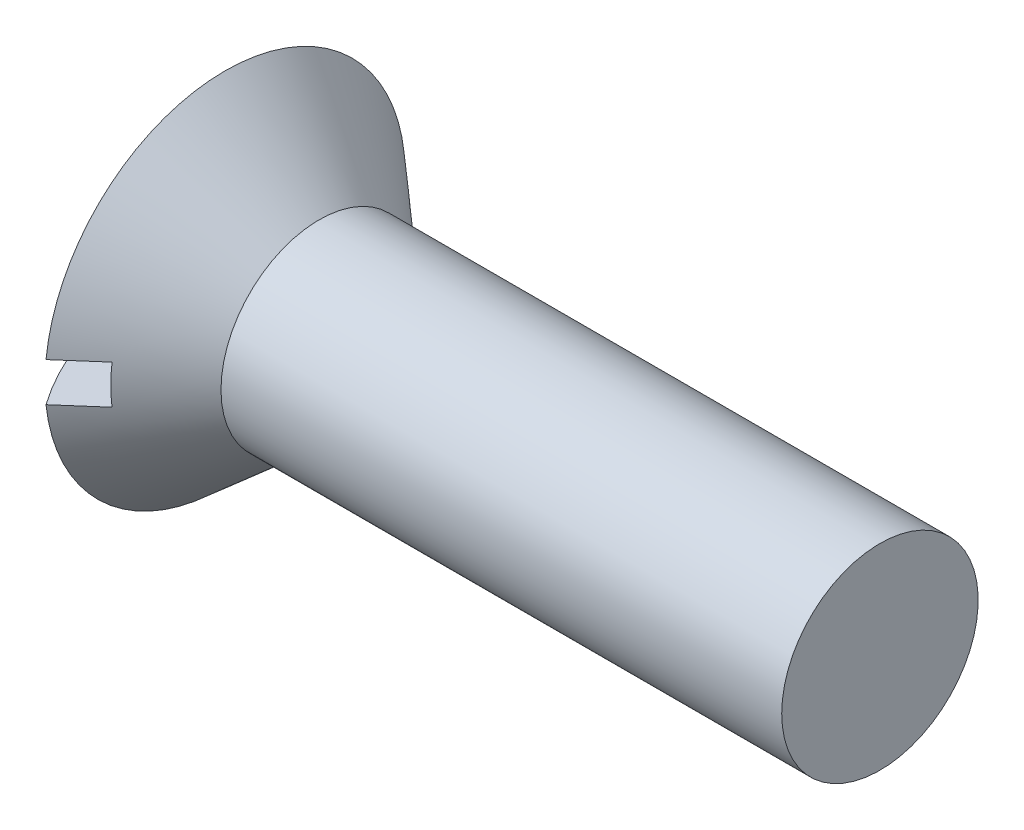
SolidWorks part; units mm, degrees
revolve "Base-Revolve" add sketch "BodySke" angle 360 about L4
sketch "BodySke" plane through (0, 0, 0) normal (0, 0, 1) x (1, 0, 0)
  line L0 (0, 0) -> (69.0502, 0)
  line L1 (69.0502, 0) -> (69.0502, 9.525)
  line L2 (69.0502, 9.525) -> (14.6812, 9.525)
  line L3 (5.5502, -17.4625) -> (14.6812, -9.525) construction
  line L4 (-15.875, 0) -> (82.55, 0) construction
  line L5 (5.5502, 17.4625) -> (14.6812, 9.525)
  line L6 (15.4749, 12.7) -> (15.475, -3.175) construction
  line L7 (37.3002, 12.7) -> (37.3002, -3.175) construction
  arc A0 (0, 0) -> (5.5502, 17.4625) centre (30.2463, 0) cw
extrude "Slot" cut sketch "Sketch2" along normal blind 8.9662
sketch "Sketch2" plane through (0, 0, 0) normal (1, 0, 0) x (0, 0, -1)
  line L0 (17.4625, -1.8923) -> (-17.4625, -1.8923)
  line L1 (17.4625, -1.8923) -> (17.4625, 1.8923)
  line L2 (-17.4625, 1.8923) -> (17.4625, 1.8923)
  line L3 (-17.4625, 1.8923) -> (-17.4625, -1.8923)
ref_plane "Plane1" through (0, 0, 0) normal (0, 0, 1) x (1, 0, 0)
ref_plane "Plane2" through (0, 0, 0) normal (0, 1, 0) x (1, 0, 0)
ref_plane "Plane3" through (0, 0, 0) normal (1, 0, 0) x (0, 0, -1)
other "Configuration Table"
sketch "Sketch3" plane through (0, 0, 0) normal (1, 0, 0) x (0, 0, -1)
  line L0 (1.3208, -8.3312) -> (-1.3208, -8.3312)
  line L1 (1.3208, -8.3312) -> (1.3208, 8.3312)
  line L2 (-1.3208, 8.3312) -> (1.3208, 8.3312)
  line L3 (-1.3208, 8.3312) -> (-1.3208, -8.3312)
ref_plane "Plane4" through (10.16, 0, 0) normal (1, 0, 0) x (0, 0, -1)
sketch "Sketch4" plane through (10.16, 0, 0) normal (1, 0, 0) x (0, 0, -1)
  line L0 (0.6604, -0.6604) -> (-0.6604, -0.6604)
  line L1 (0.6604, -0.6604) -> (0.6604, 0.6604)
  line L2 (-0.6604, 0.6604) -> (0.6604, 0.6604)
  line L3 (-0.6604, 0.6604) -> (-0.6604, -0.6604)
loft "Cross" cut profiles "Sketch3", "Sketch4"
pattern_circular "CirPattern1" count 2 every 90 about axis through (0, 0, 0) along (1, 0, 0) of "Cross"
sketch "ThdSchSke" plane through (0, 0, 0) normal (0, 0, 1) x (1, 0, 0)
  line L0 (37.3002, -8.0137) -> (36.242, -9.525)
  line L1 (37.3002, -8.0137) -> (38.3584, -9.525)
  line L2 (38.3584, -9.525) -> (38.3584, -11.9062)
  line L3 (-3.175, 0) -> (5.1513, 0) construction
  line L4 (5.5502, 17.4625) -> (5.5502, 1.8923) construction
  line L5 (38.3584, -11.9062) -> (36.242, -11.9063)
  line L6 (36.242, -11.9063) -> (36.242, -9.525)
revolve "ThreadSchematic" [suppressed] cut sketch "ThdSchSke" angle 360 about L3
pattern_linear "ThdSchPat" [suppressed]
equation "\"D1@Sketch2\" = \"Head_dia@BodySke\""
equation "\"D3@Sketch2\" = \"D1@Sketch2\" / 2"
equation "\"D4@Sketch2\" = \"Slot_width@Sketch2\" / 2"
equation "\"D1@Sketch3\" = \"Cross_width@Sketch3\" / 2"
equation "\"D2@Sketch3\" = \"Cross_dia@Sketch3\" / 2"
equation "\"D1@Sketch4\" = \"Cross_width@Sketch3\"*.5"
equation "\"D2@Sketch4\" = \"D1@Sketch4\""
equation "\"D3@Sketch4\" = \"D1@Sketch4\" / 2"
equation "\"D4@Sketch4\" = \"D2@Sketch4\" / 2"
equation "\"Thread_length@ThreadCosmetic\" = ((sgn( (\"Length@BodySke\" - \"Advance@BodySke\" - ( ( ( \"Head_dia@BodySke\" - \"Diameter@BodySke\" ) * 0.5 ) / tan( \"Head_ang@BodySke\" * 0.008726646 ) ) ) - \"Thread_nom@Body"
equation "\"Thread_minor@ThdSchSke\" = \"Thread_minor@ThreadCosmetic\""
equation "\"Diameter@ThdSchSke\" = \"Diameter@BodySke\""
equation "\"Overcut@ThdSchSke\" = \"Diameter@BodySke\" * 1.25"
equation "\"Start@ThdSchSke\" = 0.000001 + \"Length@BodySke\" - \"Thread_length@ThreadCosmetic\"  '---Countersunk---"
equation "\"Num_threads@ThdSchPat\" = int( \"Thread_length@ThreadCosmetic\" / \"Advance@BodySke\" + 0.999 )  + 1"
equation "\"Advance@ThdSchPat\" = \"Thread_length@ThreadCosmetic\" /  (\"Num_threads@ThdSchPat\" - 1) 'relax it"
